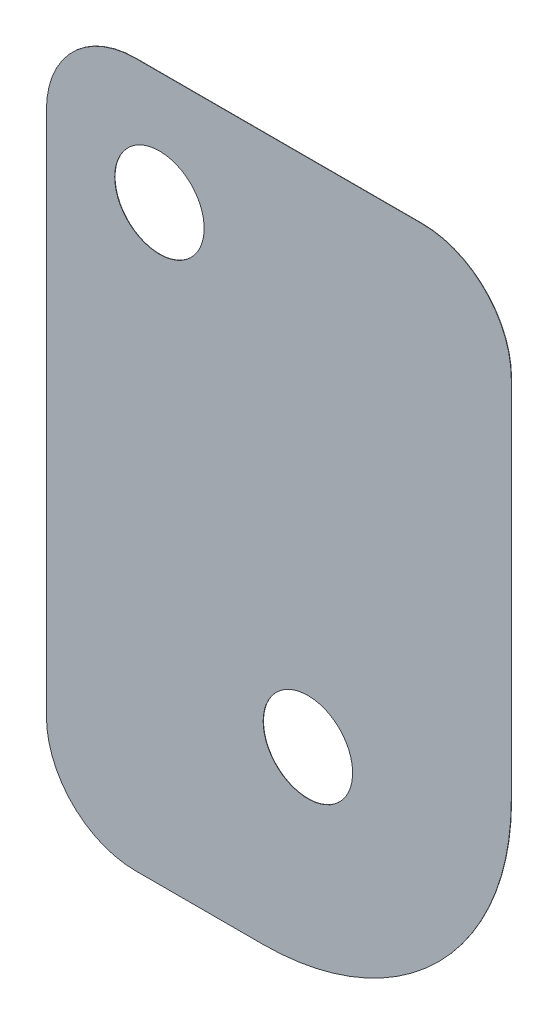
SolidWorks part; units mm, degrees
ref_plane "Front" through (0, 0, 0) normal (0, 0, 1) x (1, 0, 0)
ref_plane "Top" through (0, 0, 0) normal (0, 1, 0) x (1, 0, 0)
ref_plane "Right" through (0, 0, 0) normal (1, 0, 0) x (0, 0, -1)
ref_plane "Plane1"
sketch "Sketch1" plane through (0, 0, 15.8746) normal (0, 0, -1) x (-1, 0, 0)
  line L4 (536.321, 10.2122) -> (513.461, 10.2122)
  line L5 (543.941, -39.3178) -> (543.941, 2.5922)
  line L6 (526.161, -46.9378) -> (536.321, -46.9378)
  line L7 (505.841, 2.5922) -> (505.841, -26.6178)
  line L8 (536.321, 10.2122) -> (513.461, 10.2122)
  line L9 (543.941, -39.3178) -> (543.941, 2.5922)
  line L10 (526.161, -46.9378) -> (536.321, -46.9378)
  line L11 (505.841, 2.5922) -> (505.841, -26.6178)
  arc A4 (543.941, 2.5922) -> (536.321, 10.2122) centre (536.321, 2.5922) ccw
  arc A6 (505.841, -26.6178) -> (526.161, -46.9378) centre (526.161, -26.6178) ccw
  arc A7 (513.461, 10.2122) -> (505.841, 2.5922) centre (513.461, 2.5922) ccw
  arc A8 (543.941, 2.5922) -> (536.321, 10.2122) centre (536.321, 2.5922) ccw
  arc A10 (505.841, -26.6178) -> (526.161, -46.9378) centre (526.161, -26.6178) ccw
  arc A11 (513.461, 10.2122) -> (505.841, 2.5922) centre (513.461, 2.5922) ccw
  arc A25 (536.321, -46.9378) -> (543.941, -39.3178) centre (536.321, -39.3178) ccw
  arc A26 (536.321, -46.9378) -> (543.941, -39.3178) centre (536.321, -39.3178) ccw
sketch "Sketch2" plane through (0, 0, 15.8746) normal (0, 0, -1) x (-1, 0, 0)
  line L4 (536.321, 9.7042) -> (513.461, 9.7042)
  line L5 (506.349, 2.5922) -> (506.349, -26.6178)
  line L6 (526.161, -46.4298) -> (536.321, -46.4298)
  line L7 (543.433, -39.3178) -> (543.433, 2.5922)
  line L8 (536.321, 9.7042) -> (513.461, 9.7042)
  line L9 (506.349, 2.5922) -> (506.349, -26.6178)
  line L10 (526.161, -46.4298) -> (536.321, -46.4298)
  line L11 (543.433, -39.3178) -> (543.433, 2.5922)
  arc A4 (513.461, 9.7042) -> (506.349, 2.5922) centre (513.461, 2.5922) ccw
  arc A5 (506.349, -26.6178) -> (526.161, -46.4298) centre (526.161, -26.6178) ccw
  arc A6 (536.321, -46.4298) -> (543.433, -39.3178) centre (536.321, -39.3178) ccw
  arc A7 (543.433, 2.5922) -> (536.321, 9.7042) centre (536.321, 2.5922) ccw
  arc A8 (513.461, 9.7042) -> (506.349, 2.5922) centre (513.461, 2.5922) ccw
  arc A9 (506.349, -26.6178) -> (526.161, -46.4298) centre (526.161, -26.6178) ccw
  arc A11 (543.433, 2.5922) -> (536.321, 9.7042) centre (536.321, 2.5922) ccw
  arc A12 (536.321, -46.4298) -> (543.433, -39.3178) centre (536.321, -39.3178) ccw
extrude "Boss-Extrude1" add sketch "Sketch2" against normal blind 0.0254 flip side to cut
hole_wizard "Hole1" positions "Point_Sketch" profile "Profil_Sketch" hole size "Ø0.15" standard "ISO"
sketch "Point_Sketch" plane through (-518.9185, -20.035, 15.8746) normal (0, 0, 1) x (-1, 0, 0)
  point P0 (3.6543, 10.9736)
  point P2 (15.4975, -20.7222)
sketch "Profil_Sketch" plane through (-522.5728, -31.0086, 15.8746) normal (1, 0, 0) x (0, 1, 0)
  line L0 (0, 0) -> (0, 0.0254)
  line L1 (0, 0.0254) -> (3.5687, 0.0254)
  line L2 (3.5687, 0.0254) -> (3.5687, 0)
  line L5 (3.5687, 0) -> (0, 0)
  line L11 (0, -6.35) -> (0, 107.95) construction
  dimension "Diameter" = 7.1374
  dimension "Thru Hole Depth" = 0.0254
other "usin_DL090_.25-20x.625-SHCS<1>"
hole_wizard "Hole12" positions "Point_Sketch2" profile "Profil_Sketch2" hole size "Ø0.15" standard "ISO"
sketch "Point_Sketch2" plane through (-530.7617, 11.2883, 15.8746) normal (0, 0, 1) x (-1, 0, 0)
  point P0 (3.6543, 10.6011)
  point P2 (-8.1889, 42.2969)
sketch "Profil_Sketch2" plane through (-534.416, 0.6872, 15.8746) normal (1, 0, 0) x (0, 1, 0)
  line L0 (0, 0) -> (0, 0.0254)
  line L1 (0, 0.0254) -> (3.5687, 0.0254)
  line L2 (3.5687, 0.0254) -> (3.5687, 0)
  line L5 (3.5687, 0) -> (0, 0)
  line L11 (0, -6.35) -> (0, 107.95) construction
  dimension "Diameter" = 7.1374
  dimension "Thru Hole Depth" = 0.0254
other "usin_DL090<2>"
